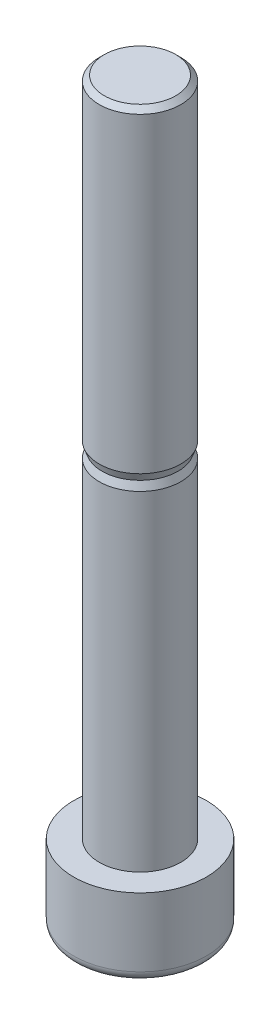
SolidWorks part; units mm, degrees
ref_plane "Piano frontale" through (0, 0, 0) normal (0, 0, 1) x (1, 0, 0)
ref_plane "Piano superiore" through (0, 0, 0) normal (0, 1, 0) x (1, 0, 0)
ref_plane "Piano destro" through (0, 0, 0) normal (1, 0, 0) x (0, 0, -1)
sketch "Schizzo1" plane through (0, 0, 0) normal (1, 0, 0) x (0, 0, -1)
  line L1 (0, 0) -> (6.5, 0)
  line L2 (0, 0) -> (0, 72.5)
  line L3 (0, 72.5) -> (3.5, 72.5)
  line L4 (6.5, 0) -> (6.5, 7.7)
  line L6 (4, 72) -> (4, 41.5)
  line L7 (4, 7.7) -> (6.5, 7.7)
  line L8 (4, 40) -> (3.727, 40.75)
  line L9 (3.727, 40.75) -> (4, 41.5)
  line L10 (4, 40) -> (4, 7.7)
  line L11 (3.5, 72.5) -> (4, 72)
  point P9 (4, 72.5)
  dimension "D1" = 6.5
  dimension "D2" = 4
  dimension "D3" = 31
  dimension "D4" = 7.7
  dimension "D5" = 160
  dimension "D6" = 72.5
  dimension "D8" = 160
  dimension "D9" = 1.5
revolve "Rivoluzione1" add sketch "Schizzo1" angle 360 about L2
sketch "Schizzo2" plane through (0, 0, 0) normal (0, -1, 0) x (1, 0, 0)
  line L1 (-1.7321, 3) -> (-3.4641, 0)
  line L2 (-3.4641, 0) -> (-1.7321, -3)
  line L3 (-1.7321, -3) -> (1.7321, -3)
  line L4 (1.7321, -3) -> (3.4641, 0)
  line L5 (3.4641, 0) -> (1.7321, 3)
  line L6 (1.7321, 3) -> (-1.7321, 3)
  circle A0 centre (0, 0) radius 3 construction
  dimension "D1" = 6
extrude "Taglio-Estrusione1" cut sketch "Schizzo2" against normal blind 5
sketch "Schizzo3" plane through (0, 0, 0) normal (1, 0, 0) x (0, 0, -1)
  line L0 (0, 0) -> (0, -3.4377) construction
  line L1 (0, 0) -> (-1.5, 0) construction
  line L3 (-1.5, 0) -> (-3.5, 0)
  line L4 (-3.5, 0) -> (-1.5, 0.3527)
  line L5 (-1.5, 0.3527) -> (-1.5, 0)
  dimension "D1" = 3.5
  dimension "D2" = 10
  dimension "D3" = 2
fillet "Raccordo1" radius 1 1 edges at (0, 0, -6.5)
revolve "Taglia-Rivoluzione2" cut sketch "Schizzo3" angle 360 about L0
